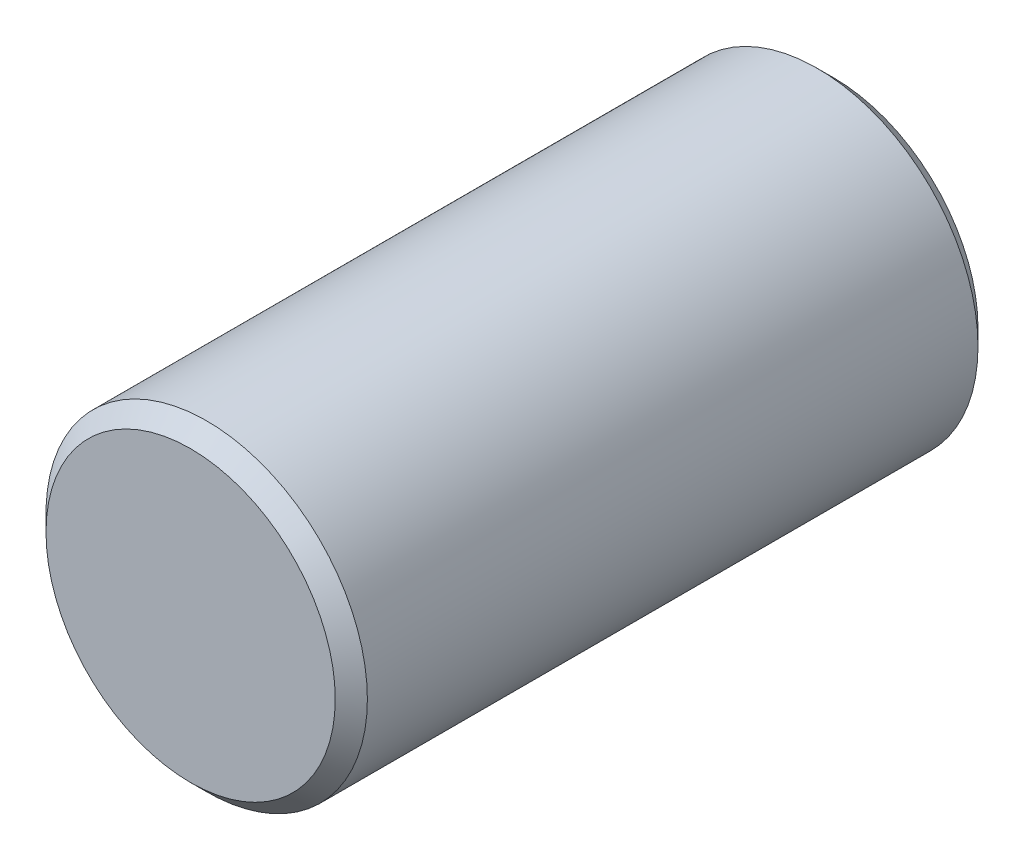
SolidWorks part; units mm, degrees
ref_plane "Plan de face" through (0, 0, 0) normal (0, 0, 1) x (1, 0, 0)
ref_plane "Plan de dessus" through (0, 0, 0) normal (0, 1, 0) x (1, 0, 0)
ref_plane "Plan de droite" through (0, 0, 0) normal (1, 0, 0) x (0, 0, -1)
sketch "Esquisse1" plane through (0, 0, 0) normal (0, 0, 1) x (1, 0, 0)
  circle A0 centre (0, 0) radius 2
  dimension "D1" = 4
extrude "Base cylindrique" add sketch "Esquisse1" along normal blind 8
chamfer "Chanfreins" distance 0.2 angle 45 2 edges at (2, 0, 8) (2, 0, 0)
